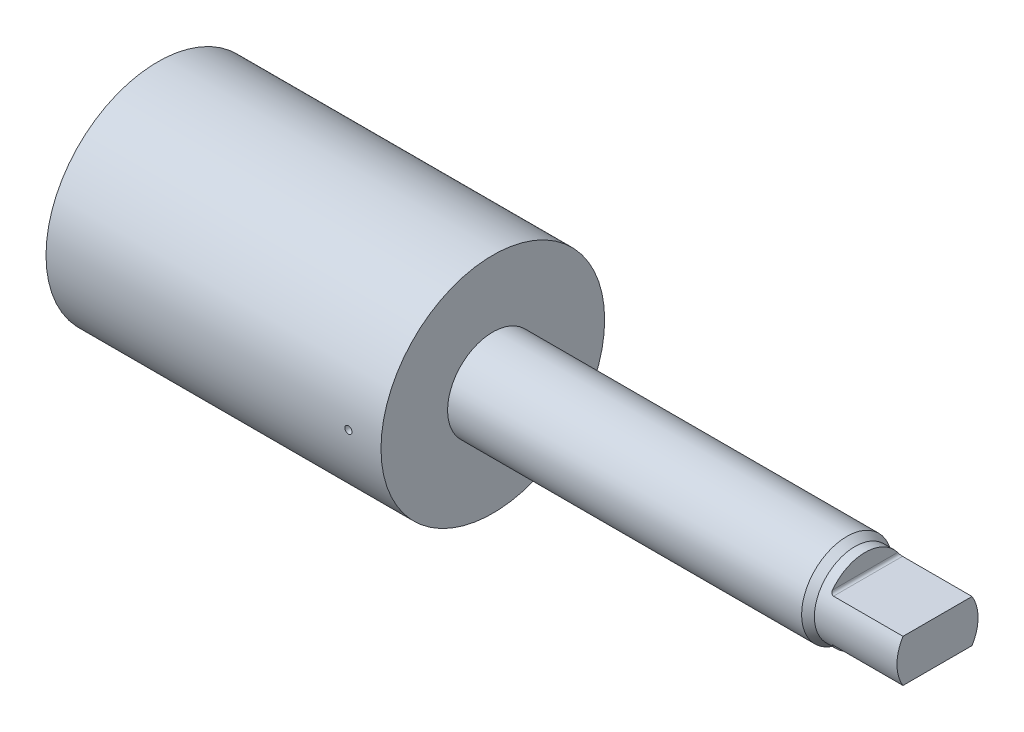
SolidWorks part; units mm, degrees
ref_plane "Front Plane" through (0, 0, 0) normal (0, 0, 1) x (1, 0, 0)
ref_plane "Top Plane" through (0, 0, 0) normal (0, 1, 0) x (1, 0, 0)
ref_plane "Right Plane" through (0, 0, 0) normal (1, 0, 0) x (0, 0, -1)
sketch "Sketch1" plane through (0, 0, 0) normal (0, 0, 1) x (1, 0, 0)
  line L0 (-2.9718, 0) -> (77.824, 0) construction
  line L1 (29.37, 3.9662) -> (60.4095, 3.9662)
  line L2 (60.4095, 3.9662) -> (61.12, 3.556)
  line L3 (61.12, 3.556) -> (68.359, 3.556)
  line L4 (68.359, 3.556) -> (68.359, 0)
  line L5 (29.37, 3.9662) -> (29.37, 9.8044)
  line L6 (29.37, 9.8044) -> (0, 9.8044)
  line L7 (26.83, 5.9944) -> (26.83, 0)
  line L8 (26.83, 0) -> (68.359, 0)
  line L9 (0, 9.8044) -> (0, 5.9944)
  line L10 (0, 5.9944) -> (26.83, 5.9944)
  dimension "D1" = 7.9324
  dimension "D2" = 11.9888
  dimension "D3" = 7.112
  dimension "D4" = 60
  dimension "D5" = 7.239
  dimension "D6" = 3.81
  dimension "D7" = 38.989
  dimension "D8" = 2.54
  dimension "D9" = 29.37
revolve "Revolve1" add sketch "Sketch1" angle 360 about L0
sketch "Sketch2" plane through (0, 0, 0) normal (0, 0, 1) x (1, 0, 0)
  line L0 (0, 0) -> (54.7119, 0) construction
  line L1 (68.359, 3.556) -> (61.12, 3.556) construction
  line L2 (62.009, 3.556) -> (68.359, 3.556)
  line L3 (62.009, 3.556) -> (62.009, 1.8669)
  line L4 (62.009, 1.8669) -> (68.359, 1.8669)
  line L5 (68.359, 3.556) -> (68.359, 1.8669)
  line L6 (68.359, -3.556) -> (68.359, -1.8669)
  line L7 (62.009, -1.8669) -> (68.359, -1.8669)
  line L8 (62.009, -3.556) -> (62.009, -1.8669)
  line L9 (62.009, -3.556) -> (68.359, -3.556)
  line L10 (68.359, -3.556) -> (68.359, 3.556) construction
  dimension "D1" = 1.8669
  dimension "D2" = 6.35
extrude "Cut-Extrude1" cut sketch "Sketch2" against normal mid plane 12.7
fillet "Fillet2" radius 0.254 2 edges at (62.009, -1.8669, 0) (62.009, 1.8669, 0)
ref_plane "Plane1" through (0, 0, 10.16) normal (0, 0, 1) x (1, 0, 0)
hole_wizard "#72 (0.025) Diameter Hole2" positions "3DSketch4" profile "Sketch7" hole size "#72" standard "ANSI Inch"
sketch3d "3DSketch4"
  line L0 (0, 0, 9.8044) -> (33.8076, 0, 9.8044) construction
  circle A0 centre (0, 0, 0) radius 9.8044 construction
  point P0 (26.5125, 0, 9.8044)
  point P11 (-9.8044, 0, 0)
  dimension "D1" = 0.3175
sketch "Sketch7" plane through (26.5125, 0, 9.8044) normal (1, 0, 0) x (0, -1, 0)
  line L0 (0, 0) -> (0, 3.81)
  line L1 (0, 3.81) -> (0.3175, 3.81)
  line L2 (0.3175, 3.81) -> (0.3175, 0)
  line L5 (0.3175, 0) -> (0, 0)
  line L11 (0, -6.35) -> (0, 107.95) construction
  dimension "Thru Hole Dia." = 0.635
  dimension "Thru Hole Depth" = 3.81
